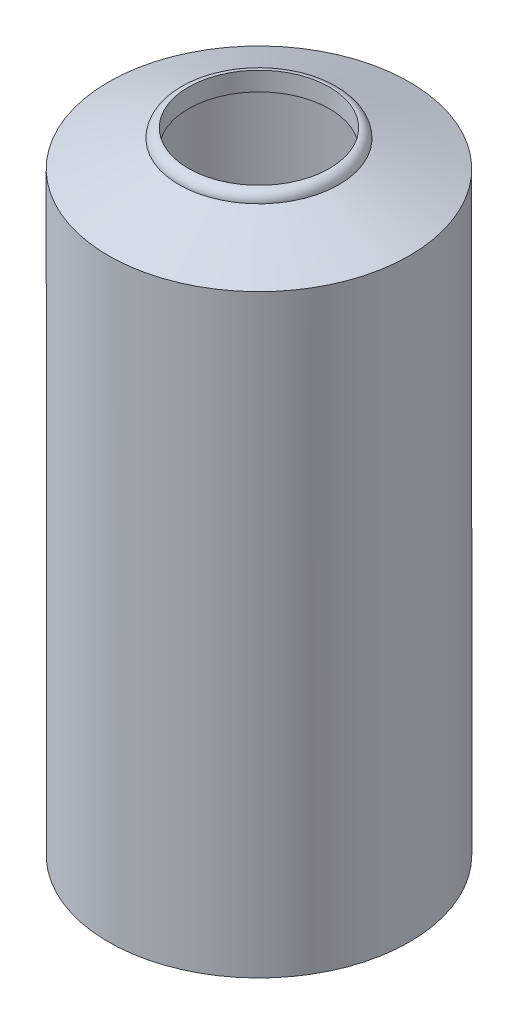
SolidWorks part; units mm, degrees
ref_plane "Front Plane" through (0, 0, 0) normal (0, 0, 1) x (1, 0, 0)
ref_plane "Top Plane" through (0, 0, 0) normal (0, 1, 0) x (1, 0, 0)
ref_plane "Right Plane" through (0, 0, 0) normal (1, 0, 0) x (0, 0, -1)
sketch "Sketch1" plane through (0, 0, 0) normal (0, 0, 1) x (1, 0, 0)
  line L0 (0, 0) -> (0, 1579.88)
  line L2 (0, 0) -> (25.4, 0)
  line L3 (0, 1579.88) -> (190.5, 1650.5906)
  line L4 (406.4, -33.6753) -> (406.4, 1625.1906) construction
  line L5 (25.4, 0) -> (25.4, 1562.2147)
  line L6 (25.4, 1562.2147) -> (195.062, 1625.1906)
  line L7 (195.062, 1625.1906) -> (406.4, 1625.1906)
  line L9 (215.9, 1675.9906) -> (406.4, 1675.9906)
  line L10 (406.4, 1675.9906) -> (406.4, 1625.1906)
  line L11 (215.9, 1650.5906) -> (190.5, 1650.5906) construction
  arc A0 (215.9, 1675.9906) -> (190.5, 1650.5906) centre (215.9, 1650.5906) ccw
  point P3 (95.25, 1615.2353)
  dimension "D3" = 25.4
  dimension "D1" = 1579.88
  dimension "D2" = 211.338
  dimension "D4" = 50.8
  dimension "D5" = 406.4
  dimension "D6" = 25.4
  dimension "D7" = 25.4
  dimension "D9" = 203.2
revolve "Revolve1" add sketch "Sketch1" angle 360 about L4
sketch "Sketch6" plane through (0, 1675.9906, 0) normal (0, 1, 0) x (1, 0, 0)
  circle A0 centre (406.4, 0) radius 190.5
  circle A1 centre (406.4, 0) radius 190.5 construction
  point P2 (0, 0)
  dimension "D1" = 381
extrude "Cut-Extrude1" cut sketch "Sketch6" against normal blind 127
sketch "Sketch3" plane through (0, 0, 0) normal (0, -1, 0) x (1, 0, 0)
  line L0 (0, 0) -> (812.8, 0) construction
  circle A1 centre (406.4, 0) radius 406.4 construction
  circle A2 centre (406.4, 0) radius 406.4
  dimension "D1" = 812.8
extrude "Boss-Extrude1" add sketch "Sketch3" along normal blind 25.4
